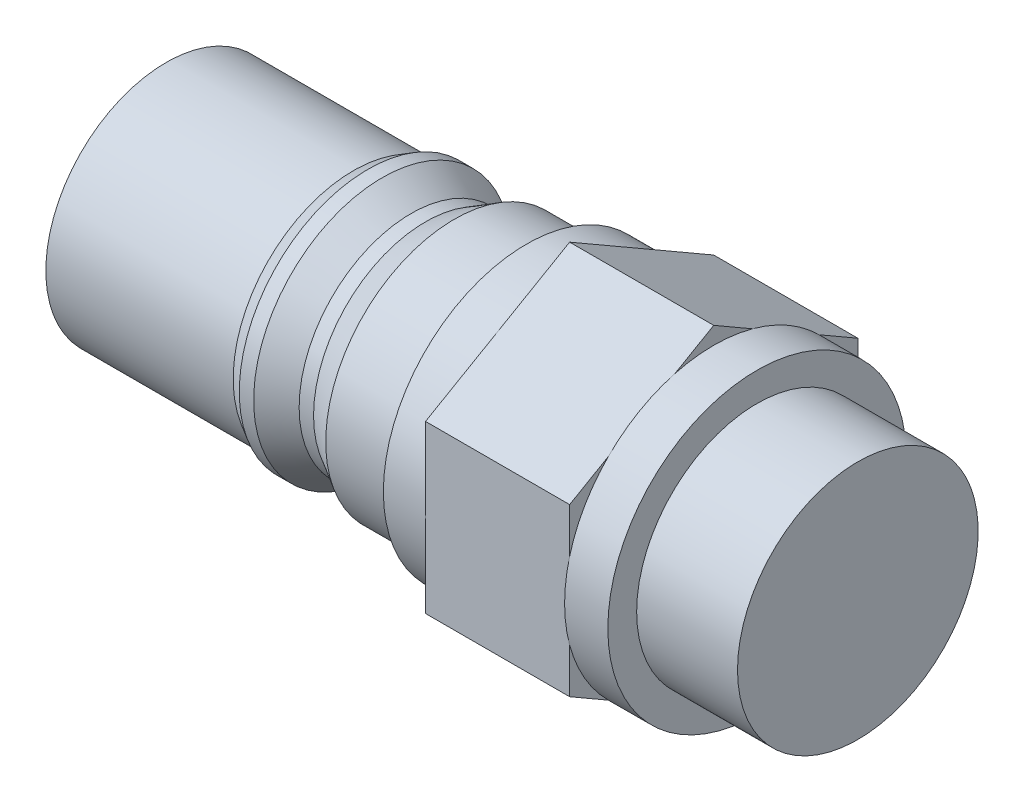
SolidWorks part; units mm, degrees
ref_plane "Alzado" through (0, 0, 0) normal (0, 0, 1) x (1, 0, 0)
ref_plane "Planta" through (0, 0, 0) normal (0, 1, 0) x (1, 0, 0)
ref_plane "Vista lateral" through (0, 0, 0) normal (1, 0, 0) x (0, 0, -1)
sketch "Croquis1" plane through (0, 0, 0) normal (0, 0, 1) x (1, 0, 0)
  line L0 (0, 0) -> (28, 0) construction
  line L1 (0, 0) -> (0, 8.35)
  line L2 (0, 8.35) -> (13, 8.35)
  line L3 (13, 8.35) -> (14, 8.9274)
  line L4 (14, 8.9274) -> (15, 8.9274)
  line L5 (14.5, 8.9274) -> (14.5, 0) construction
  line L6 (16, 8.35) -> (15, 8.9274)
  line L7 (16, 8.35) -> (17, 7.7726)
  line L8 (17, 7.7726) -> (18, 7.7726)
  line L9 (17.5, 7.7726) -> (17.5, 0) construction
  line L10 (19, 8.35) -> (18, 7.7726)
  line L11 (19, 8.35) -> (20, 8.9274)
  line L12 (20, 8.9274) -> (25, 8.9274)
  line L14 (28, 0) -> (0, 0)
  line L15 (25, 8.9274) -> (25, 9.9274)
  line L16 (25, 9.9274) -> (28, 9.9274)
  line L17 (28, 9.9274) -> (28, 0)
  point P18 (27.5743, 0)
  dimension "D1" = 16.7
  dimension "D2" = 13
  dimension "D3" = 1
  dimension "D4" = 1
  dimension "D5" = 150
  dimension "D6" = 1
  dimension "D7" = 1
  dimension "D8" = 5
  dimension "D9" = 1
  dimension "D10" = 3
revolve "Revolución1" add sketch "Croquis1" angle 360 about L14
sketch "Croquis8" plane through (28, 0, 0) normal (1, 0, 0) x (0, 0, -1)
  line L1 (0, 11.547) -> (-10, 5.7735)
  line L2 (-10, 5.7735) -> (-10, -5.7735)
  line L3 (-10, -5.7735) -> (0, -11.547)
  line L4 (0, -11.547) -> (10, -5.7735)
  line L5 (10, -5.7735) -> (10, 5.7735)
  line L6 (10, 5.7735) -> (0, 11.547)
  circle A0 centre (0, 0) radius 10 construction
  dimension "D1" = 20
extrude "Saliente-Extruir6" add sketch "Croquis8" along normal blind 10
sketch "Croquis10" plane through (0, 0, 0) normal (0, 0, 1) x (1, 0, 0)
  line L0 (38, 0) -> (48, 0) construction
  line L1 (38, 5.7735) -> (38, -5.7735) construction
  line L2 (48, 0) -> (48, 8.35)
  line L3 (48, 8.35) -> (41, 8.35)
  line L4 (41, 8.35) -> (41, 10.35)
  line L5 (41, 10.35) -> (38, 10.35)
  line L6 (38, 10.35) -> (38, 0)
  line L7 (38, 0) -> (48, 0)
  line L8 (38, 0) -> (108.8542, 0) construction
  dimension "D1" = 10
  dimension "D2" = 3
  dimension "D3" = 16.7
  dimension "D4" = 2
revolve "Revolución3" add sketch "Croquis10" angle 360 about L8
